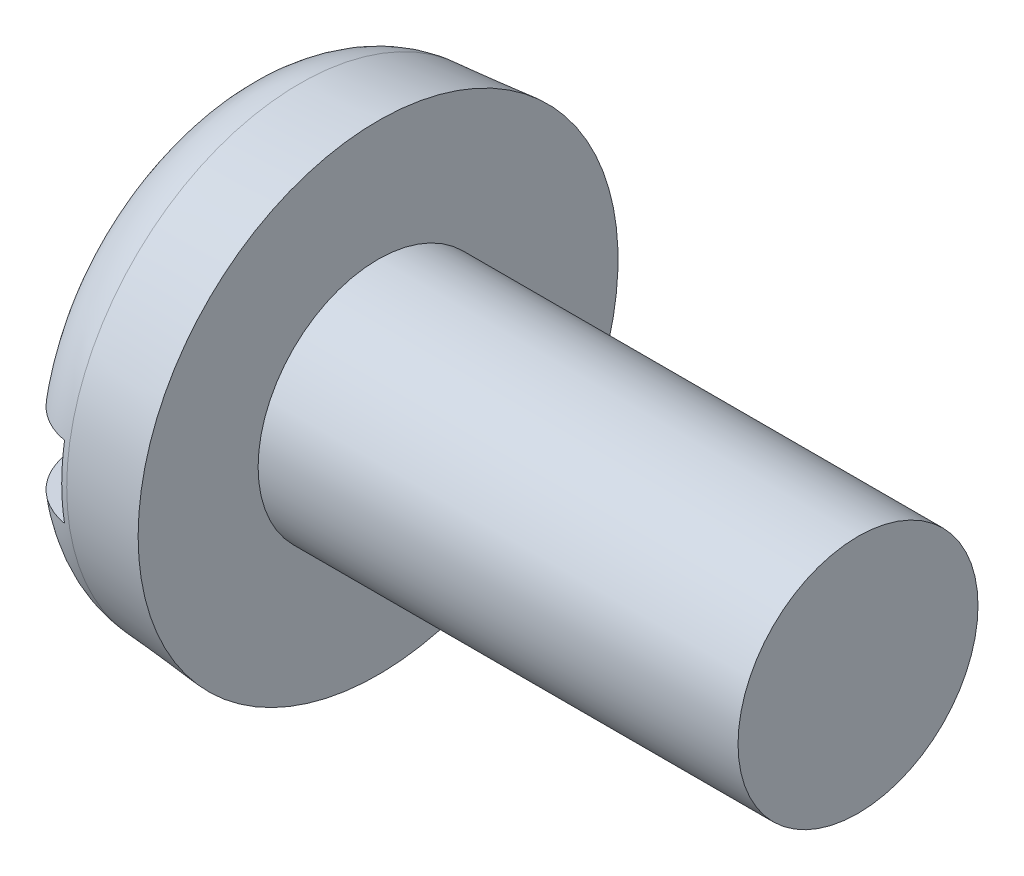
SolidWorks part; units mm, degrees
ref_plane "Plane1" through (0, 0, 0) normal (0, 0, 1) x (1, 0, 0)
ref_plane "Plane2" through (0, 0, 0) normal (0, 1, 0) x (1, 0, 0)
ref_plane "Plane3" through (0, 0, 0) normal (1, 0, 0) x (0, 0, -1)
sketch "BodySke" plane through (0, 0, 0) normal (0, 0, 1) x (1, 0, 0)
  line L0 (2.4, 2) -> (2.4, 4)
  line L1 (0, 0) -> (0, 3.79)
  line L2 (-25.4, 0) -> (127, 0) construction
  line L3 (10.4, 0) -> (0, 0)
  line L4 (2.4, 2) -> (10.4, 2)
  line L5 (10.4, 2) -> (10.4, 0)
  line L6 (0, 3.79) -> (2.4, 4)
  line L9 (3.1, 3.5875) -> (3.1, -5.9375) construction
  line L10 (2.4, 6.35) -> (2.4, -3.175) construction
  dimension "Head_ht" = 2.4
  dimension "Diameter" = 4
  dimension "Length" = 8
  dimension "Head_dia" = 8
  dimension "Advance" = 0.7
  dimension "Thread_nom" = 8
  dimension "Head_side_angle" = 5
revolve "Base-Revolve" add sketch "BodySke"
fillet "Fillet1" [suppressed] radius 0.2
fillet "Fillet2" radius 1.2 1 edges at (0, 0, 3.79)
sketch "Sketch2" plane through (0, 0, 0) normal (1, 0, 0) x (0, 0, -1)
  line L0 (4, -0.6) -> (-4, -0.6)
  line L1 (4, -0.6) -> (4, 0.6)
  line L2 (-4, 0.6) -> (4, 0.6)
  line L3 (-4, 0.6) -> (-4, -0.6)
  dimension "D1" = 8
  dimension "D2" = 4
  dimension "Slot_width" = 1.2
  dimension "D3" = 0.6
extrude "Slot" cut sketch "Sketch2" along normal blind 1
sketch "ThdSchSke" plane through (0, 0, 0) normal (0, 0, 1) x (1, 0, 0)
  line L0 (3.8, -1.61) -> (3.5269, -2)
  line L1 (3.8, -1.61) -> (4.0731, -2)
  line L2 (4.0731, -2) -> (4.0731, -2.5)
  line L3 (-3.175, 0) -> (5.1513, 0) construction
  line L5 (4.0731, -2.5) -> (3.5269, -2.5)
  line L6 (3.5269, -2.5) -> (3.5269, -2)
  dimension "Thread_minor" = 3.22
  dimension "Diameter" = 4
  dimension "Start" = 3.8
  dimension "SideAngle" = 55
  dimension "VeeAngle" = 70
  dimension "Overcut" = 5
revolve "ThreadSchematic" [suppressed] cut sketch "ThdSchSke" angle 360 about L3
pattern_linear "ThdSchPat" [suppressed]
equation "\"D1@Sketch2\" = \"Head_dia@BodySke\""
equation "\"D2@Sketch2\" = \"D1@Sketch2\" / 2"
equation "\"D3@Sketch2\" = \"Slot_width@Sketch2\" / 2"
equation "\"Thread_length@ThreadCosmetic\" = ((sgn( (\"Length@BodySke\" - \"Advance@BodySke\" * 2.0 ) - \"Thread_nom@BodySke\" )-1)*( (\"Length@BodySke\" - \"Advance@BodySke\"  * 2.0) - \"Thread_nom@BodySke\" ))/-2+ \"Thread_"
equation "\"Thread_minor@ThdSchSke\" = \"Thread_minor@ThreadCosmetic\""
equation "\"Diameter@ThdSchSke\" = \"Diameter@BodySke\""
equation "\"Overcut@ThdSchSke\" = \"Diameter@BodySke\" * 1.25"
equation "\"Start@ThdSchSke\" = \"Head_ht@BodySke\" + \"Length@BodySke\" - \"Thread_length@ThreadCosmetic\"  '---Non-countersunk---"
equation "\"Num_threads@ThdSchPat\" = int( \"Thread_length@ThreadCosmetic\" / \"Advance@BodySke\" + 0.999 )  + 1"
equation "\"Advance@ThdSchPat\" = \"Thread_length@ThreadCosmetic\" /  (\"Num_threads@ThdSchPat\" - 1) 'relax it"
